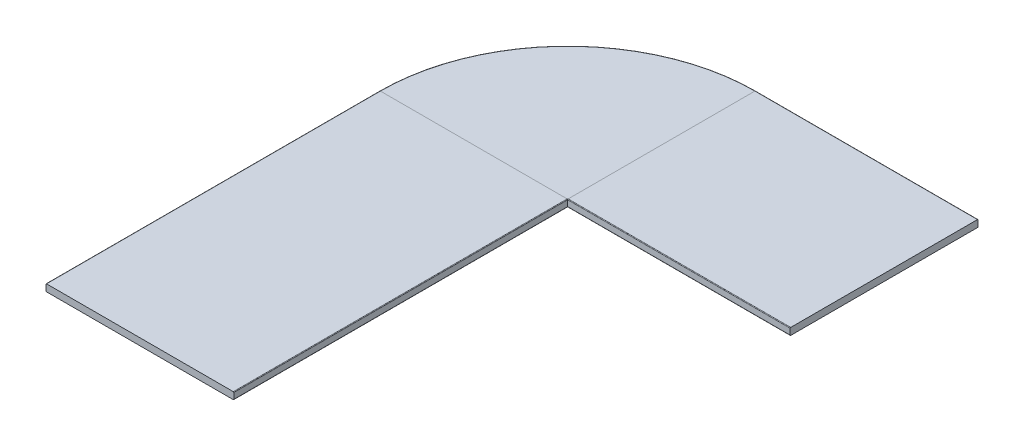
SolidWorks part; units mm, degrees
ref_plane "Front" through (0, 0, 0) normal (0, 0, 1) x (1, 0, 0)
ref_plane "Top" through (0, 0, 0) normal (0, 1, 0) x (1, 0, 0)
ref_plane "Right" through (0, 0, 0) normal (1, 0, 0) x (0, 0, -1)
sketch "Sketch1" plane through (0, 0, 0) normal (0, 1, 0) x (1, 0, 0)
  line L0 (0, 0) -> (0, 1219.2)
  line L1 (685.8, 1905) -> (1498.6, 1905)
  line L2 (1498.6, 1905) -> (1498.6, 1219.2)
  line L3 (1498.6, 1219.2) -> (685.8, 1219.2)
  line L4 (685.8, 1219.2) -> (685.8, 0)
  line L5 (685.8, 0) -> (0, 0)
  arc A0 (0, 1219.2) -> (685.8, 1905) centre (685.8, 1219.2) cw
  dimension "D1" = 1905
  dimension "D2" = 1498.6
  dimension "D3" = 685.8
  dimension "D4" = 685.8
extrude "Extrude1" add sketch "Sketch1" along normal blind 762
shell "Shell1" thickness 25.4
sketch "Sketch2" plane through (0, 762, 0) normal (0, 1, 0) x (-1, 0, 0)
  line L0 (-685.8, -1219.2) -> (0, -1219.2)
sketch "Sketch3" plane through (0, 762, 0) normal (0, 1, 0) x (-1, 0, 0)
  line L0 (-685.8, -1219.2) -> (-685.8, -1905)
fillet "Fillet1" radius 2.032 7 edges at (1092.2, 762, -1905) (0, 762, -609.6) (200.8662, 762, -1704.1338) (1092.2, 736.6, -1219.2) (685.8, 736.6, -609.6) (685.8, 762, -609.6) (1092.2, 762, -1219.2)
